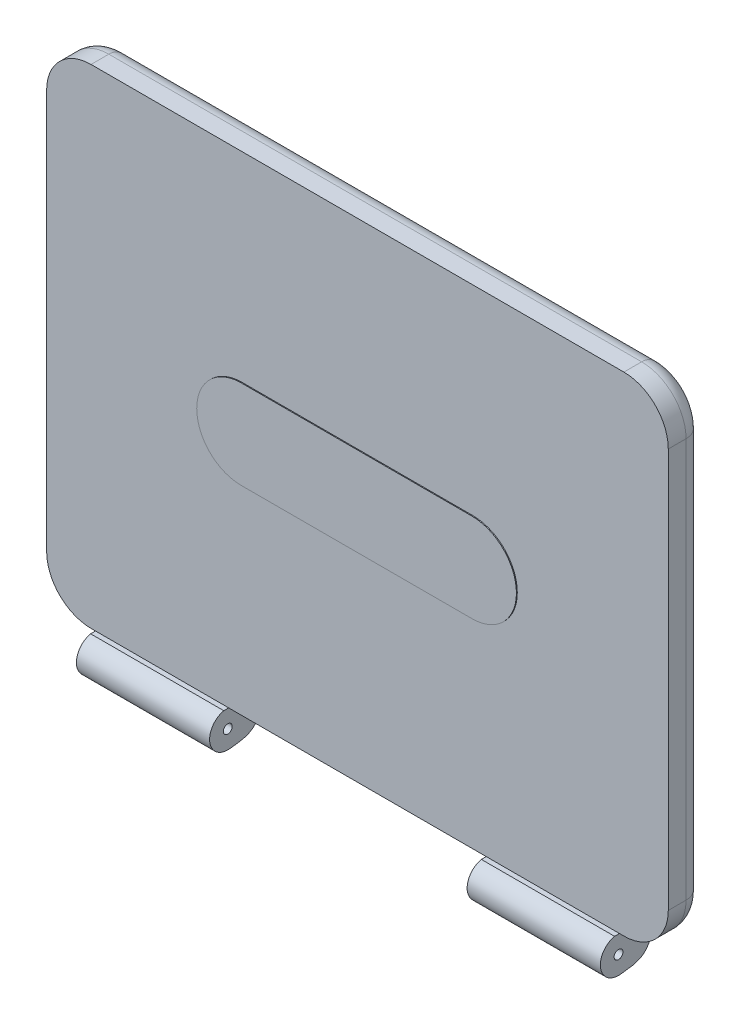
SolidWorks part; units mm, degrees
ref_plane "Plan de face" through (0, 0, 0) normal (0, 0, 1) x (1, 0, 0)
ref_plane "Plan de dessus" through (0, 0, 0) normal (0, 1, 0) x (1, 0, 0)
ref_plane "Plan de droite" through (0, 0, 0) normal (1, 0, 0) x (0, 0, -1)
sketch "Esquisse1" plane through (0, 0, 0) normal (0, 0, 1) x (1, 0, 0)
  line L1 (5, 0) -> (65, 0)
  line L2 (0, 5) -> (0, 50)
  line L3 (5, 55) -> (65, 55)
  line L4 (70, 5) -> (70, 50)
  arc A0 (5, 0) -> (0, 5) centre (5, 5) cw
  arc A1 (0, 50) -> (5, 55) centre (5, 50) cw
  arc A2 (65, 55) -> (70, 50) centre (65, 50) cw
  arc A3 (65, 0) -> (70, 5) centre (65, 5) ccw
  point P7 (0, 0)
  point P10 (0, 55)
  point P13 (70, 55)
  point P16 (70, 0)
  dimension "D3" = 5
  dimension "D1" = 70
  dimension "D2" = 55
extrude "Extrusion1" add sketch "Esquisse1" along normal blind 4
fillet "Congé1" radius 2 8 edges at (35, 0, 0) (68.5355, 1.4645, 0) (70, 27.5, 0) (68.5355, 53.5355, 0) (35, 55, 0) (1.4645, 53.5355, 0) (0, 27.5, 0) (1.4645, 1.4645, 0)
sketch "Esquisse2" plane through (0, 0, 4) normal (0, 0, 1) x (1, 0, 0)
  line L0 (5, 0) -> (65, 0) construction
  line L1 (22, 32.5) -> (48, 32.5)
  line L2 (22, 22.5) -> (48, 22.5)
  line L3 (70, 5) -> (70, 50) construction
  line L4 (0, 50) -> (0, 5) construction
  arc A0 (22, 32.5) -> (22, 22.5) centre (22, 27.5) ccw
  arc A1 (48, 22.5) -> (48, 32.5) centre (48, 27.5) ccw
  dimension "D3" = 22
  dimension "D4" = 22
  dimension "D5" = 10
  dimension "D1" = 27.5
  dimension "D2" = 27.5
extrude "Extrusion2" add sketch "Esquisse2" along normal blind 0.1
sketch "Esquisse3" plane through (49.5, 0, 0) normal (1, 0, 0) x (0, 0, -1)
  line L1 (-4.55, 0) -> (-4, 0)
  line L2 (-4.1, 0) -> (-4.55, 0)
  line L3 (-4.1, 0.05) -> (-4.1, 0)
  line L5 (-4, 0) -> (0, 2)
  arc A1 (-4.55, 0) -> (-4.1, 0.05) centre (-4.1, -2) ccw
  arc A2 (-4.55, 0) -> (-3.8736, -4.0375) centre (-4.1, -2) ccw
  point P8 (-1.5864, -3.5282)
  dimension "D1" = 0
extrude "Extrusion4" add sketch "Esquisse3" along normal blind 15
sketch "Esquisse4" plane through (20.5, 0, 0) normal (-1, 0, 0) x (0, 0, 1)
  line L2 (4.55, 0) -> (4, 0)
  line L3 (4, 0) -> (2, 0)
  line L4 (4.55, 0) -> (4, 0)
  line L5 (4, 0) -> (2, 0)
  arc A2 (0.002, 1.9116) -> (2, 0) centre (2, 2) ccw
  arc A3 (3.8736, -4.0375) -> (4.55, 0) centre (4.1, -2) ccw
  arc A4 (0.002, 1.9116) -> (2, 0) centre (2, 2) ccw
  arc A5 (3.8736, -4.0375) -> (4.55, 0) centre (4.1, -2) ccw
  dimension "D1" = 0
extrude "Extrusion5" add sketch "Esquisse4" along normal blind 15
sketch "Esquisse5" plane through (64.5, 0, 0) normal (1, 0, 0) x (0, 0, -1)
  circle A0 centre (-4.1, -2) radius 0.5
  dimension "D1" = 1
extrude "Enlèv. mat.-Extru.1" cut sketch "Esquisse5" against normal through all
